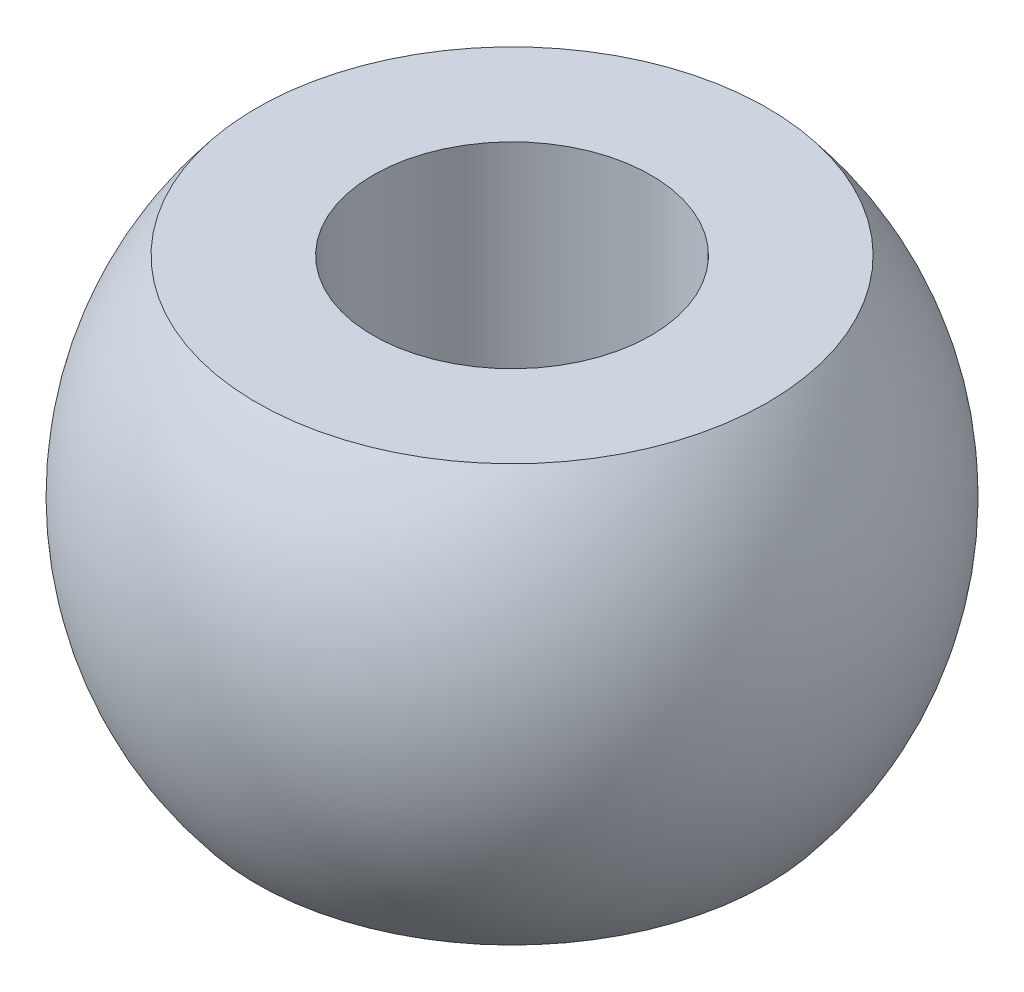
SolidWorks part; units mm, degrees
ref_plane "Front" through (0, 0, 0) normal (0, 0, 1) x (1, 0, 0)
ref_plane "Top" through (0, 0, 0) normal (0, 1, 0) x (1, 0, 0)
ref_plane "Right" through (0, 0, 0) normal (1, 0, 0) x (0, 0, -1)
sketch "Sketch1" plane through (0, 0, 0) normal (0, 0, 1) x (1, 0, 0)
  line L0 (0, 21.5067) -> (0, -21.5067) construction
  line L1 (3.175, 4.7625) -> (3.175, -4.7625)
  line L2 (3.175, -4.7625) -> (5.834, -4.7625)
  line L3 (-19.3507, 0) -> (19.3507, 0) construction
  line L4 (3.175, 4.7625) -> (5.834, 4.7625)
  arc A0 (5.834, -4.7625) -> (5.834, 4.7625) centre (0, 0) ccw
  dimension "D3" = 7.5311
  dimension "D1" = 9.525
  dimension "D2" = 6.35
revolve "Revolve1" add sketch "Sketch1" angle 360 about L0
ref_point "Point1"
